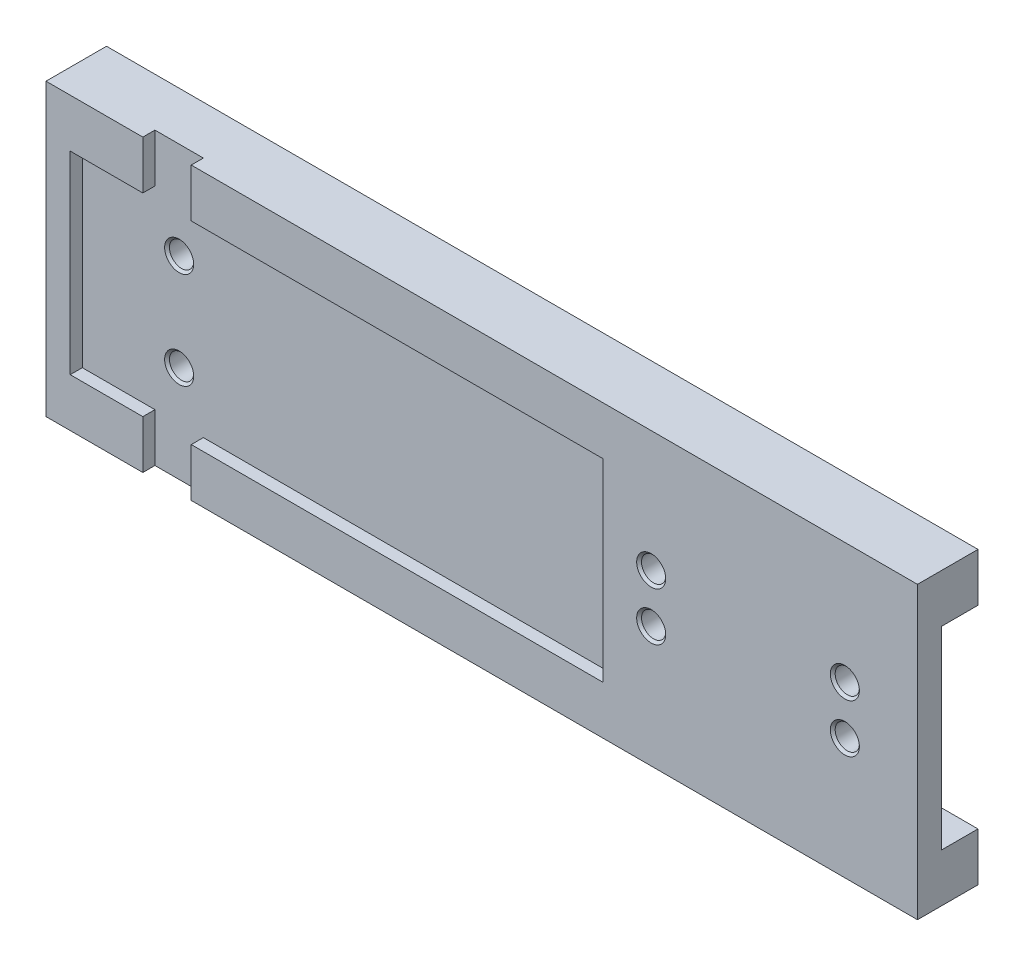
SolidWorks part; units mm, degrees
ref_plane "Front Plane" through (0, 0, 0) normal (0, 0, 1) x (1, 0, 0)
ref_plane "Top Plane" through (0, 0, 0) normal (0, 1, 0) x (1, 0, 0)
ref_plane "Right Plane" through (0, 0, 0) normal (1, 0, 0) x (0, 0, -1)
sketch "Sketch1" plane through (0, 0, 0) normal (0, 0, 1) x (1, 0, 0)
  line L1 (-95.4538, 46.7139) -> (133.1462, 46.7139)
  line L2 (-95.4538, 46.7139) -> (-95.4538, -29.4861)
  line L3 (-95.4538, -29.4861) -> (133.1462, -29.4861)
  line L4 (133.1462, 46.7139) -> (133.1462, -29.4861)
extrude "Boss-Extrude1" add sketch "Sketch1" along normal blind 15.875
sketch "Sketch3" plane through (0, 0, 15.875) normal (0, 0, 1) x (1, 0, 0)
  line L0 (133.1462, 46.7139) -> (-95.4538, 46.7139) construction
  line L1 (-89.1038, 34.0139) -> (50.5962, 34.0139)
  line L2 (-89.1038, 34.0139) -> (-89.1038, -16.7861)
  line L3 (-89.1038, -16.7861) -> (50.5962, -16.7861)
  line L4 (50.5962, 34.0139) -> (50.5962, -16.7861)
  line L5 (-95.4538, 46.7139) -> (-95.4538, -29.4861) construction
  dimension "D1" = 139.7
  dimension "D2" = 50.8
  dimension "D3" = 12.7
  dimension "D4" = 6.35
extrude "Cut-Extrude1" cut sketch "Sketch3" against normal blind 3.175
sketch "Sketch4" plane through (0, 0, 15.875) normal (0, 0, 1) x (1, 0, 0)
  line L0 (133.1462, 46.7139) -> (-95.4538, 46.7139) construction
  line L1 (-70.0538, 46.7139) -> (-57.3538, 46.7139)
  line L2 (-70.0538, 46.7139) -> (-70.0538, -29.4861)
  line L3 (-70.0538, -29.4861) -> (-57.3538, -29.4861)
  line L4 (-57.3538, 46.7139) -> (-57.3538, -29.4861)
  line L5 (-89.1038, 34.0139) -> (-89.1038, -16.7861) construction
  dimension "D1" = 19.05
extrude "Cut-Extrude2" cut sketch "Sketch4" against normal blind 3.175
hole_wizard "1/4 (0.25) Diameter Hole2" positions "Sketch7" profile "Sketch8" hole size "1/4" standard "ANSI Inch"
sketch "Sketch7" plane through (0, 0, 12.7) normal (0, 0, 1) x (1, 0, 0)
  line L0 (-57.3538, 46.7139) -> (-70.0538, 46.7139) construction
  line L1 (-57.3538, 34.0139) -> (-57.3538, 46.7139) construction
  point P0 (-63.7038, 21.3139)
  point P2 (-63.7038, -4.0861)
  dimension "D1" = 25.4
  dimension "D2" = 25.4
  dimension "D3" = 6.35
sketch "Sketch8" plane through (-63.7038, 21.3139, 12.7) normal (1, 0, 0) x (0, -1, 0)
  line L0 (0, 0) -> (0, 12.7)
  line L1 (0, 12.7) -> (3.175, 12.7)
  line L2 (3.175, 12.7) -> (3.175, 0.635)
  line L3 (3.175, 0.635) -> (3.81, 0)
  line L5 (3.81, 0) -> (0, 0)
  line L6 (-3.175, 0.635) -> (-3.81, 0) construction
  line L11 (0, -6.35) -> (0, 107.95) construction
  dimension "Thru Hole Dia." = 6.35
  dimension "Thru Hole Depth" = 12.7
  dimension "Near C'Sink Dia." = 7.62
  dimension "Near C'Sink Angle" = 90
sketch "Sketch10" plane through (0, 0, 0) normal (0, 0, -1) x (-1, 0, 0)
  line L0 (-133.1462, -29.4861) -> (-133.1462, 46.7139) construction
  line L1 (-133.1462, 34.0139) -> (-56.9462, 34.0139)
  line L2 (-133.1462, 34.0139) -> (-133.1462, -16.7861)
  line L3 (-133.1462, -16.7861) -> (-56.9462, -16.7861)
  line L4 (-56.9462, 34.0139) -> (-56.9462, -16.7861)
  line L5 (-133.1462, 46.7139) -> (95.4538, 46.7139) construction
  line L6 (95.4538, -29.4861) -> (-133.1462, -29.4861) construction
  dimension "D1" = 12.7
  dimension "D2" = 12.7
  dimension "D3" = 76.2
extrude "Cut-Extrude4" cut sketch "Sketch10" against normal blind 9.525
hole_wizard "1/4 (0.25) Diameter Hole5" positions "Sketch16" profile "Sketch17" hole size "1/4" standard "ANSI Inch"
sketch "Sketch16" plane through (0, 0, 15.875) normal (0, 0, 1) x (1, 0, 0)
  line L0 (133.1462, 46.7139) -> (-57.3538, 46.7139) construction
  line L1 (50.5962, -16.7861) -> (50.5962, 34.0139) construction
  point P0 (63.2962, 14.9639)
  point P2 (63.2962, 2.2639)
  point P4 (114.0962, 2.2298)
  point P6 (114.0962, 14.9639)
  point P11 (0, 0)
  point P12 (0, 0)
  point P13 (0, 0)
  dimension "D1" = 31.75
  dimension "D2" = 12.7
  dimension "D3" = 31.75
  dimension "D4" = 12.7341
  dimension "D5" = 12.7
  dimension "D6" = 50.8
sketch "Sketch17" plane through (63.2962, 14.9639, 15.875) normal (1, 0, 0) x (0, -1, 0)
  line L0 (0, 0) -> (0, 15.875)
  line L1 (0, 15.875) -> (3.175, 15.875)
  line L2 (3.175, 15.875) -> (3.175, 0.635)
  line L3 (3.175, 0.635) -> (3.81, 0)
  line L5 (3.81, 0) -> (0, 0)
  line L6 (-3.175, 0.635) -> (-3.81, 0) construction
  line L11 (0, -6.35) -> (0, 107.95) construction
  dimension "Thru Hole Dia." = 6.35
  dimension "Thru Hole Depth" = 15.875
  dimension "Near C'Sink Dia." = 7.62
  dimension "Near C'Sink Angle" = 90
